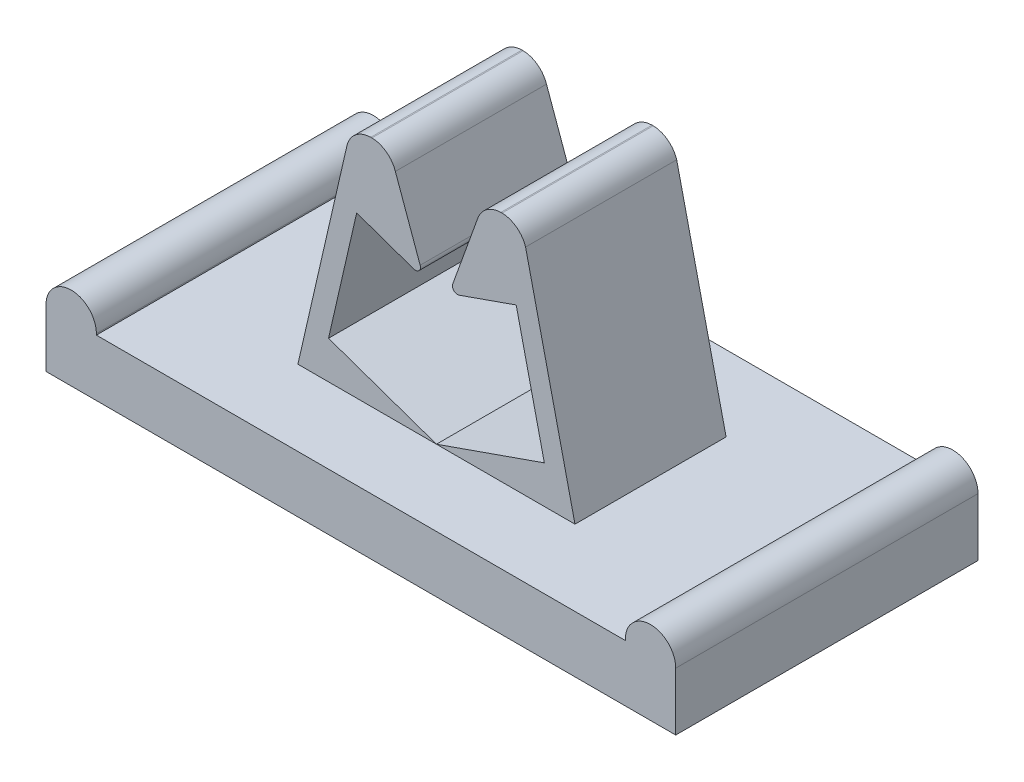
SolidWorks part; units mm, degrees
ref_plane "Plan de face" through (0, 0, 0) normal (0, 0, 1) x (1, 0, 0)
ref_plane "Plan de dessus" through (0, 0, 0) normal (0, 1, 0) x (1, 0, 0)
ref_plane "Plan de droite" through (0, 0, 0) normal (1, 0, 0) x (0, 0, -1)
sketch "Esquisse1" plane through (0, 0, 0) normal (0, 1, 0) x (1, 0, 0)
  line L1 (0, 0) -> (25, 0)
  line L2 (0, 0) -> (0, 12)
  line L3 (0, 12) -> (25, 12)
  line L4 (25, 0) -> (25, 12)
extrude "Extrusion1" add sketch "Esquisse1" along normal blind 11.5
sketch "Esquisse2" plane through (0, 0, 0) normal (0, 0, 1) x (1, 0, 0)
  line L0 (29.4112, 0) -> (-1.195, 0) construction
  line L1 (23, 2.25) -> (23, 2.3)
  line L2 (13.1464, 8.0797) -> (14.1311, 10.8127)
  line L3 (12.5, -4.4593) -> (12.5, 13.0624) construction
  line L4 (29.4112, 3.3) -> (19.9388, 3.3) construction
  line L5 (15.1057, 11.5) -> (25, 11.5)
  line L6 (18, -1.5903) -> (18, 4.3641) construction
  line L7 (15.9, 13.2956) -> (15.9, 10.093) construction
  line L8 (18, 2.25) -> (23, 2.25)
  line L9 (13, 13.0624) -> (13, 6.5838) construction
  line L10 (26.3683, 7.7) -> (10.4172, 7.7) construction
  line L11 (24, 1.499) -> (24, 2.98) construction
  line L12 (23, 1.499) -> (23, 3.8507) construction
  line L13 (22.5363, 2.3) -> (25.0945, 2.3) construction
  line L14 (15.6664, 8.6195) -> (16.7837, 3.75)
  line L15 (12.5, 2.25) -> (16.7837, 3.75)
  line L16 (13.3375, 3.75) -> (18.6872, 3.75) construction
  line L17 (25, 11.5) -> (25, 0) construction
  line L18 (16.0386, 10.7981) -> (18, 2.25)
  line L19 (12.5, 11.5) -> (15.0593, 11.5)
  line L20 (25, 2.3) -> (25, 11.5)
  line L21 (12.5, 2.25) -> (8.2163, 3.75)
  line L22 (9.3336, 8.6195) -> (8.2163, 3.75)
  line L23 (9.3336, 8.6195) -> (11.5991, 7.8232)
  line L24 (11.8536, 8.0797) -> (10.8689, 10.8127)
  line L25 (15.6664, 8.6195) -> (13.4009, 7.8232)
  line L26 (12.5, 11.5) -> (9.9407, 11.5)
  line L27 (8.9614, 10.7981) -> (7, 2.25)
  line L28 (9.8943, 11.5) -> (0, 11.5)
  line L29 (0, 2.3) -> (0, 11.5)
  line L30 (7, 2.25) -> (2, 2.25)
  line L31 (2, 2.25) -> (2, 2.3)
  arc A0 (16.0386, 10.7981) -> (15.1057, 11.5) centre (15.0825, 10.4982) ccw
  arc A1 (25, 2.3) -> (23, 2.3) centre (24, 2.3) ccw
  arc A2 (11.5991, 7.8232) -> (11.8536, 8.0797) centre (11.6654, 8.0119) ccw
  arc A3 (13.4009, 7.8232) -> (13.1464, 8.0797) centre (13.3346, 8.0119) cw
  arc A4 (9.9407, 11.5) -> (10.8689, 10.8127) centre (9.9175, 10.4982) cw
  arc A5 (8.9614, 10.7981) -> (9.8943, 11.5) centre (9.9175, 10.4982) cw
  arc A6 (0, 2.3) -> (2, 2.3) centre (1, 2.3) cw
  arc A8 (15.0593, 11.5) -> (14.1311, 10.8127) centre (15.0825, 10.4982) ccw
  dimension "D12" = 0.2
  dimension "D2" = 1
  dimension "D3" = 3.3
  dimension "D4" = 1
  dimension "D5" = 1
  dimension "D6" = 3.4
  dimension "D7" = 0.5
extrude "Enlèv. mat.-Extru.1" cut sketch "Esquisse2" against normal through all
ref_plane "Plan1" through (5, 0, 0) normal (-1, 0, 0) x (0, 0, 1)
sketch "Esquisse3" plane through (5, 0, 0) normal (-1, 0, 0) x (0, 0, 1)
  line L0 (-6, 13.3812) -> (-6, -3.1307) construction
  line L1 (-3, 13.3812) -> (-3, -1.5724) construction
  line L2 (-12.3577, 2.25) -> (0.8219, 2.25) construction
  line L3 (0, 13.3812) -> (0, -3.1307) construction
  line L4 (1.8715, 0) -> (-15.587, 0) construction
  line L5 (-9, 11.7958) -> (-12.2568, 11.7958)
  line L6 (-3, 2.25) -> (0.2568, 2.25)
  line L7 (-3, 2.25) -> (-3, 11.7958)
  line L8 (-3, 11.7958) -> (0.2568, 11.7958)
  line L9 (0.2568, 2.25) -> (0.2568, 11.7958)
  line L10 (-12.2568, 2.25) -> (-12.2568, 11.7958)
  line L11 (-9, 2.25) -> (-9, 11.7958)
  line L12 (-9, 2.25) -> (-12.2568, 2.25)
  dimension "D1" = 6
  dimension "D2" = 3
  dimension "D3" = 2.25
extrude "Enlèv. mat.-Extru.2" cut sketch "Esquisse3" against normal blind 15
